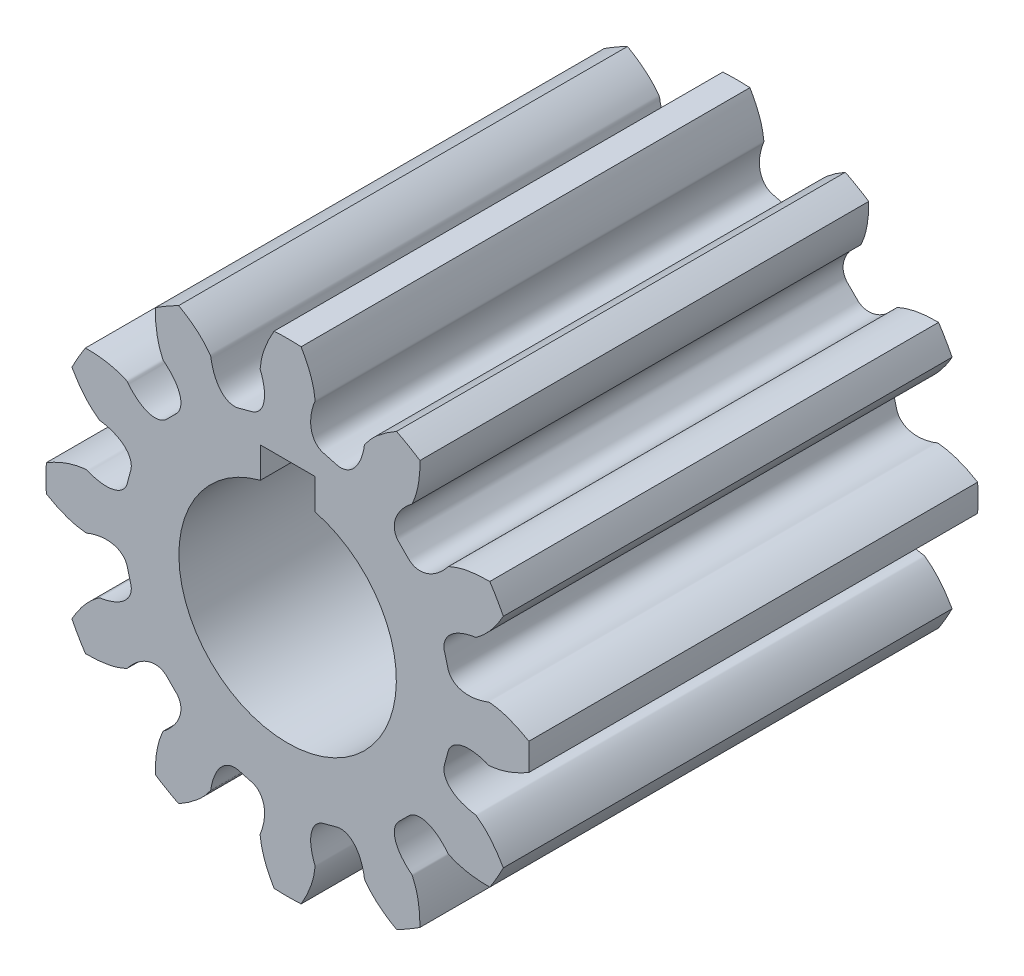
SolidWorks part; units mm, degrees
ref_plane "Front Plane" through (0, 0, 0) normal (0, 0, 1) x (1, 0, 0)
ref_plane "Top Plane" through (0, 0, 0) normal (0, 1, 0) x (1, 0, 0)
ref_plane "Right Plane" through (0, 0, 0) normal (1, 0, 0) x (0, 0, -1)
imported_body "Imported3"
sketch "Sketch1" plane through (0, 0, 9.525) normal (0, 0, 1) x (1, 0, 0)
  line L0 (1, 5) -> (-1, 5)
  line L1 (-1, 5) -> (-1, 3.873)
  line L2 (1, 3.873) -> (1, 5)
  arc A0 (-1, 3.873) -> (1, 3.873) centre (0, 0) cw
extrude "Cut-Extrude1" cut sketch "Sketch1" against normal through all
ref_plane "Plane1" through (0, 0, 0) normal (0, -1, 0) x (1, 0, 0)
sketch "Sketch2" plane through (0, 0, 0) normal (0, -1, 0) x (1, 0, 0)
  line L0 (4, 9.525) -> (0, 9.525)
  line L1 (0, 9.525) -> (0, -9.525)
  line L2 (0, -9.525) -> (4, -9.525)
  line L3 (4, -9.525) -> (4, 9.525)
  line L4 (0, 9.525) -> (0, -9.525) construction
revolve "Cut-Revolve1" cut sketch "Sketch2" angle 360 about L4
sketch "Sketch3" plane through (0, 0, 9.525) normal (0, 0, 1) x (1, 0, 0)
  circle A0 centre (0, 0) radius 17.9965
extrude "Cut-Extrude2" cut sketch "Sketch3" against normal blind 2.54
